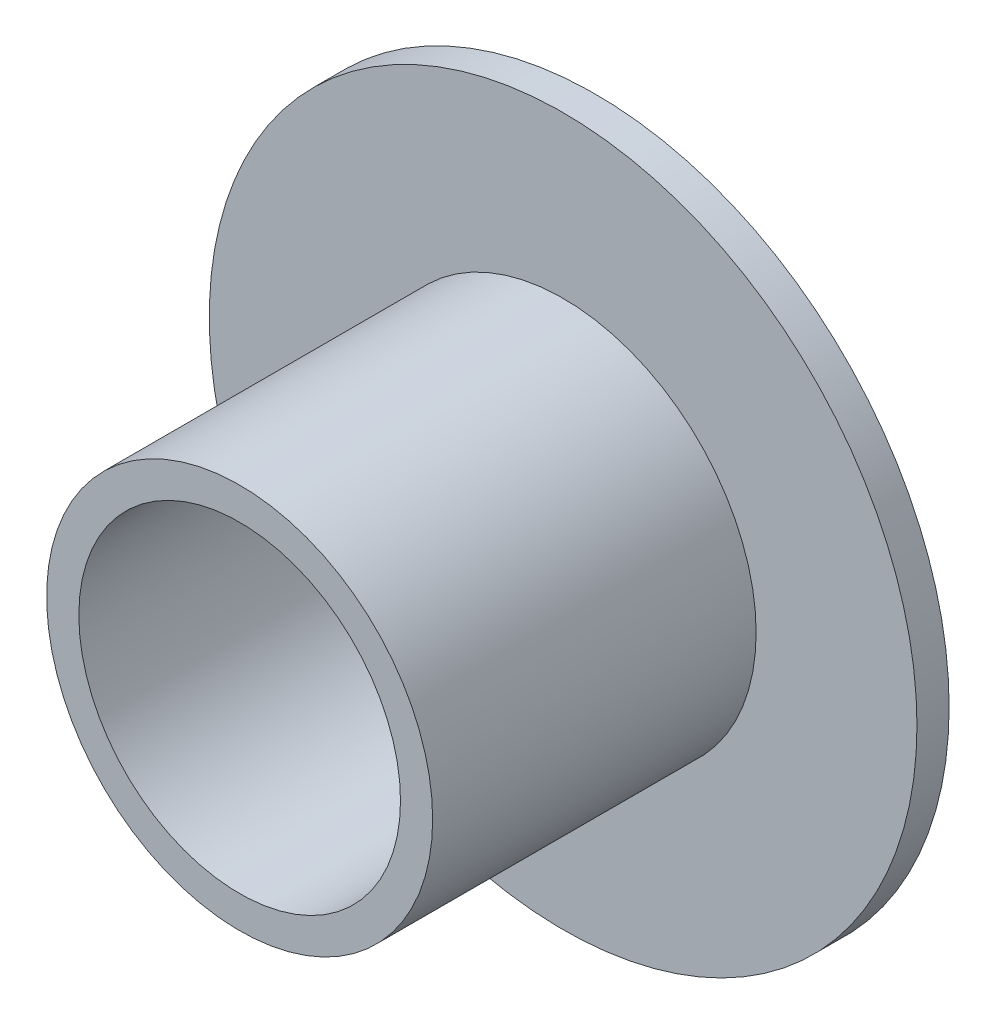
SolidWorks part; units mm, degrees
ref_plane "Plane1" through (0, 0, 0) normal (0, 0, 1) x (1, 0, 0)
ref_plane "Plane2" through (0, 0, 0) normal (0, 1, 0) x (1, 0, 0)
ref_plane "Plane3" through (0, 0, 0) normal (1, 0, 0) x (0, 0, -1)
sketch "Sketch1" plane through (0, 0, -10) normal (0, 0, 1) x (1, 0, 0)
  circle A0 centre (0, 0) radius 110 construction
  circle A1 centre (0, 0) radius 110
  circle A3 centre (0, 0) radius 50 construction
  circle A4 centre (0, 0) radius 50
extrude "Base-Extrude" add sketch "Sketch1" along normal blind 10
sketch "Sketch2" plane through (0, 0, 0) normal (0, 0, 1) x (1, 0, 0)
  circle A0 centre (0, 0) radius 50 construction
  circle A1 centre (0, 0) radius 50
  circle A2 centre (0, 0) radius 60 construction
  circle A3 centre (0, 0) radius 60
extrude "Extrude1" add sketch "Sketch2" along normal blind 100.55
